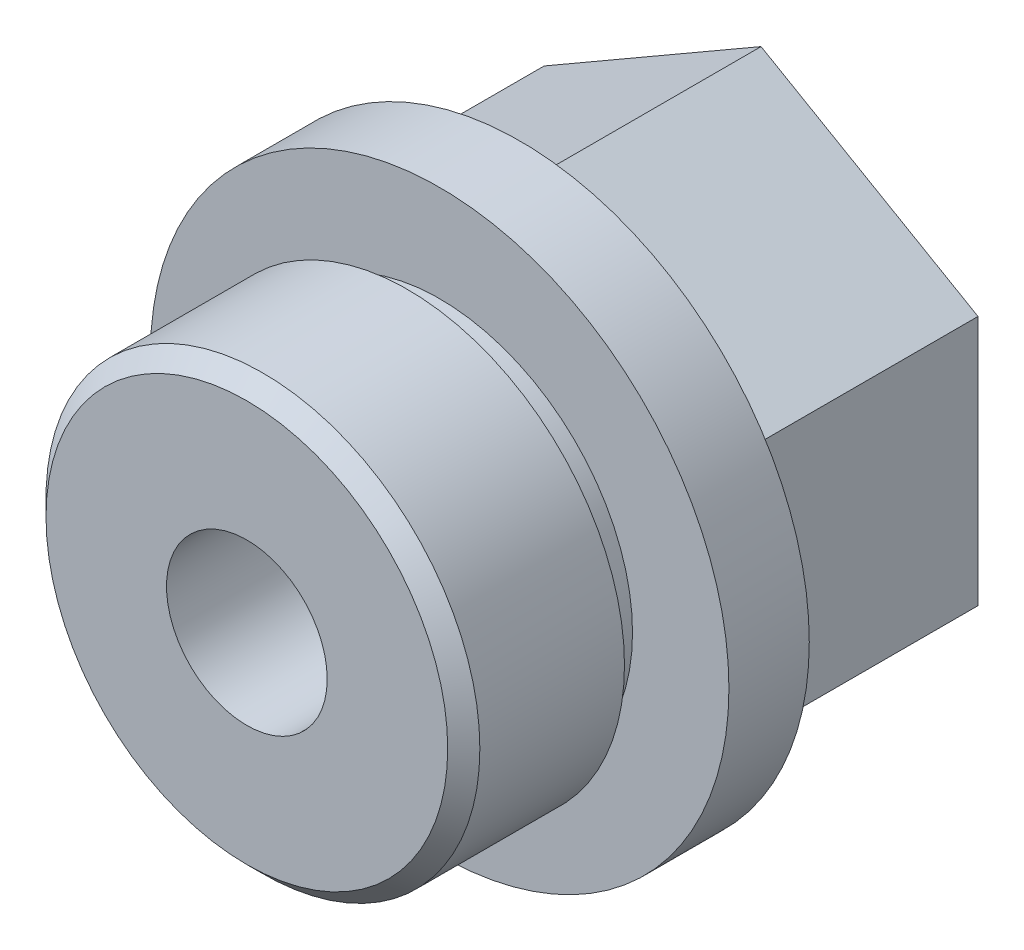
SolidWorks part; units mm, degrees
ref_plane "前视" through (0, 0, 0) normal (0, 0, 1) x (1, 0, 0)
ref_plane "上视" through (0, 0, 0) normal (0, 1, 0) x (1, 0, 0)
ref_plane "右视" through (0, 0, 0) normal (1, 0, 0) x (0, 0, -1)
sketch "草图1" plane through (0, 0, 0) normal (0, 0, 1) x (1, 0, 0)
  line L1 (0, -15.5885) -> (13.5, -7.7942)
  line L2 (13.5, -7.7942) -> (13.5, 7.7942)
  line L3 (13.5, 7.7942) -> (0, 15.5885)
  line L4 (0, 15.5885) -> (-13.5, 7.7942)
  line L5 (-13.5, 7.7942) -> (-13.5, -7.7942)
  line L6 (-13.5, -7.7942) -> (0, -15.5885)
  circle A0 centre (0, 0) radius 13.5 construction
  dimension "D1" = 27
extrude "拉伸1" add sketch "草图1" along normal blind 15
sketch "草图2" plane through (0, 0, 15) normal (0, 0, 1) x (1, 0, 0)
  circle A0 centre (0, 0) radius 18
  dimension "D1" = 36
extrude "拉伸2" add sketch "草图2" along normal blind 5
sketch "草图3" plane through (0, 0, 20) normal (0, 0, 1) x (1, 0, 0)
  circle A0 centre (0, 0) radius 12
  dimension "D1" = 24
extrude "拉伸3" add sketch "草图3" along normal blind 2
sketch "草图4" plane through (0, 0, 22) normal (0, 0, 1) x (1, 0, 0)
  circle A0 centre (0, 0) radius 13.5
  circle A1 centre (0, 0) radius 12 construction
  dimension "D1" = 27
extrude "拉伸4" add sketch "草图4" along normal blind 10
chamfer "倒角1" distance 1 angle 45
sketch "草图5" plane through (0, 0, 0) normal (1, 0, 0) x (0, 0, -1)
  line L0 (-32.9412, 0) -> (-32.9412, 5)
  line L1 (-20, 0) -> (-15, 0) construction
  line L2 (-32, 5) -> (-12, 5)
  line L3 (-32, 12.5) -> (-32, -12.5) construction
  line L4 (-32, 5) -> (-32.9412, 5)
  line L5 (-32.9412, 0) -> (-9.1132, 0)
  line L6 (-12, 5) -> (-9.1132, 0)
  line L7 (-38.7765, 0) -> (-6.9647, 0) construction
  dimension "D1" = 5
  dimension "D2" = 20
  dimension "D3" = 60
revolve "切除-旋转1" cut sketch "草图5" angle 360 about L7
